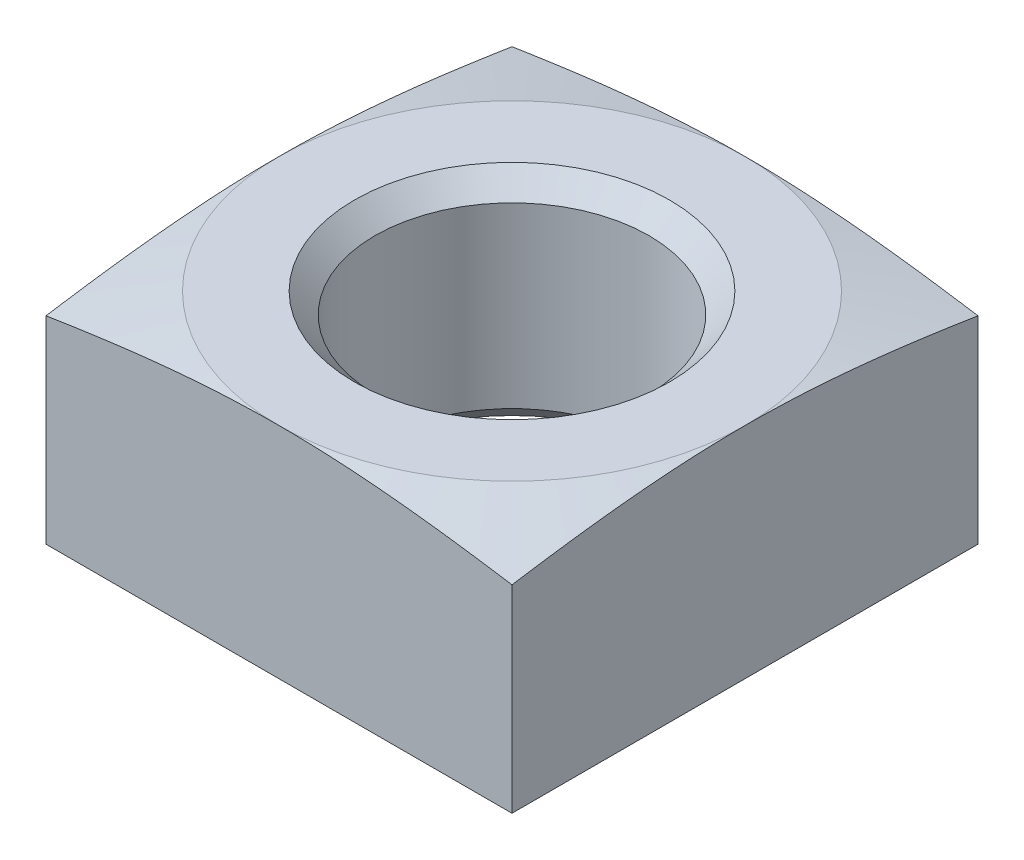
SolidWorks part; units mm, degrees
ref_plane "Front Plane" through (0, 0, 0) normal (0, 0, 1) x (1, 0, 0)
ref_plane "Top Plane" through (0, 0, 0) normal (0, 1, 0) x (1, 0, 0)
ref_plane "Right Plane" through (0, 0, 0) normal (1, 0, 0) x (0, 0, -1)
sketch "Sketch6" plane through (0, 0, 0) normal (1, 0, 0) x (0, 0, -1)
  line L0 (0, 59.8384) -> (0, -60.7908) construction
sketch "Sketch8" plane through (0, 0, 0) normal (1, 0, 0) x (0, 0, -1)
  line L1 (8.5, 4) -> (-8.5, 4)
  line L2 (8.5, 4) -> (8.5, -4)
  line L3 (8.5, -4) -> (-8.5, -4)
  line L4 (-8.5, 4) -> (-8.5, -4)
  line L5 (8.5, 4) -> (-8.5, -4) construction
  line L6 (8.5, -4) -> (-8.5, 4) construction
  point P0 (0, 0)
  dimension "D1" = 8
  dimension "D2" = 17
extrude "Boss-Extrude2" add sketch "Sketch8" along normal mid plane 17
sketch "Sketch10" plane through (0, 0, 0) normal (1, 0, 0) x (0, 0, -1)
  line L0 (-8.5, 4) -> (-12.1, 4)
  line L1 (-12.1, 4) -> (-12.1, 3.2)
  line L2 (-12.1, 3.2) -> (-8.5, 4)
  point P0 (-8.5, 4)
  point P6 (-8.5, 4)
  dimension "D1" = 0.8
  dimension "D2" = 3.6
revolve "Cut-Revolve1" cut sketch "Sketch10" angle 360 about L0
sketch "Sketch11" plane through (0, 4, 0) normal (0, 1, 0) x (1, 0, 0)
  circle A0 centre (0, 0) radius 5
  dimension "D1" = 10
extrude "Cut-Extrude1" cut sketch "Sketch11" against normal up to surface (8 mm away)
chamfer "Chamfer1" distance 0.75 angle 45 2 edges at (0, 4, 5) (0, -4, 5)
